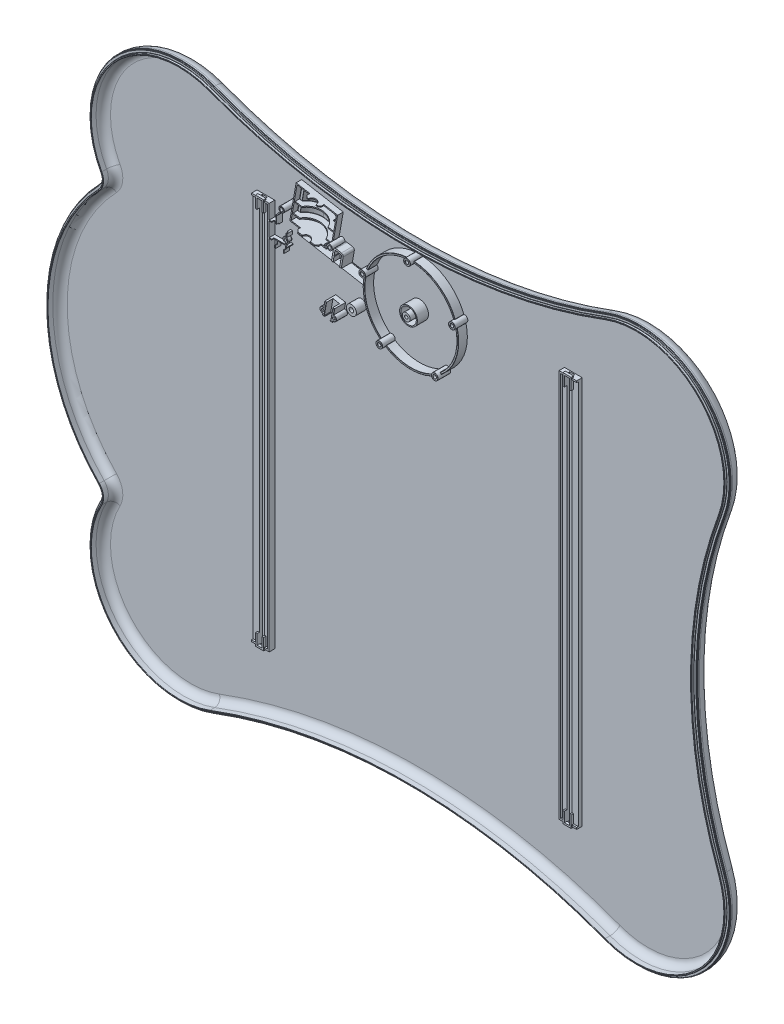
SolidWorks part; units mm, degrees
ref_plane "Face" through (0, 0, 0) normal (0, 0, 1) x (1, 0, 0)
ref_plane "Dessus" through (0, 0, 0) normal (0, 1, 0) x (1, 0, 0)
ref_plane "Droite" through (0, 0, 0) normal (1, 0, 0) x (0, 0, -1)
sketch "Esquisse4" plane through (0, 0, 0) normal (0, 0, 1) x (1, 0, 0)
  line L0 (257.1874, 0) -> (-480.8465, 0) construction
  line L1 (0, 0) -> (0, 296.3249) construction
  arc A0 (-176.824, 244.6687) -> (-278.609, 128.3314) centre (-206, 167.5) ccw
  arc A1 (176.824, 244.6687) -> (283.3693, 138.8601) centre (206, 167.5) cw
  arc A2 (-176.824, 244.6687) -> (176.824, 244.6687) centre (0, 712.358) ccw
  arc A3 (283.3693, 138.8601) -> (283.3693, -138.8601) centre (658.4931, 0) ccw
  arc A4 (-278.609, 128.3314) -> (-280.2321, 116.6212) centre (-287.4101, 123.5836) cw
  arc A5 (-280.2321, 116.6212) -> (-280.2321, -116.6212) centre (-160, 0) ccw
  arc A6 (-278.609, -128.3314) -> (-280.2321, -116.6212) centre (-287.4101, -123.5836) ccw
  arc A7 (-176.824, -244.6687) -> (176.824, -244.6687) centre (0, -712.358) cw
  arc A8 (176.824, -244.6687) -> (283.3693, -138.8601) centre (206, -167.5) ccw
  arc A9 (-176.824, -244.6687) -> (-278.609, -128.3314) centre (-206, -167.5) cw
  dimension "D1" = 82.5
  dimension "D4" = 500
  dimension "D5" = 400
  dimension "D6" = 167.5
  dimension "D8" = 10
  dimension "D2" = 412
  dimension "D3" = 167.5
  dimension "D7" = 160
extrude "Extrusion1" add sketch "Esquisse4" along normal blind 11.5
fillet "Congé1" radius 10
shell "Coque1" thickness 3.5
sketch "Esquisse5" plane through (0, 0, 11.5) normal (0, 0, 1) x (1, 0, 0)
  arc A0 (280.087, 140.0751) -> (178.0618, 241.3949) centre (206, 167.5) ccw construction
  arc A1 (-178.0618, 241.3949) -> (178.0618, 241.3949) centre (0, 712.358) ccw construction
  arc A2 (-178.0618, 241.3949) -> (-275.5286, 129.9931) centre (-206, 167.5) ccw construction
  arc A3 (-277.7198, 114.1843) -> (-275.5286, 129.9931) centre (-287.4101, 123.5836) ccw construction
  arc A4 (-277.7198, 114.1843) -> (-277.7198, -114.1843) centre (-160, 0) ccw construction
  arc A5 (-275.5286, -129.9931) -> (-277.7198, -114.1843) centre (-287.4101, -123.5836) ccw construction
  arc A6 (-275.5286, -129.9931) -> (-178.0618, -241.3949) centre (-206, -167.5) ccw construction
  arc A7 (178.0618, -241.3949) -> (-178.0618, -241.3949) centre (0, -712.358) ccw construction
  arc A8 (178.0618, -241.3949) -> (280.087, -140.0751) centre (206, -167.5) ccw construction
  arc A9 (280.087, 140.0751) -> (280.087, -140.0751) centre (658.4931, 0) ccw construction
  arc A10 (280.087, 140.0751) -> (178.0618, 241.3949) centre (206, 167.5) ccw
  arc A11 (-178.0618, 241.3949) -> (178.0618, 241.3949) centre (0, 712.358) ccw
  arc A12 (-178.0618, 241.3949) -> (-275.5286, 129.9931) centre (-206, 167.5) ccw
  arc A13 (-277.7198, 114.1843) -> (-275.5286, 129.9931) centre (-287.4101, 123.5836) ccw
  arc A14 (-277.7198, 114.1843) -> (-277.7198, -114.1843) centre (-160, 0) ccw
  arc A15 (-275.5286, -129.9931) -> (-277.7198, -114.1843) centre (-287.4101, -123.5836) ccw
  arc A16 (-275.5286, -129.9931) -> (-178.0618, -241.3949) centre (-206, -167.5) ccw
  arc A17 (178.0618, -241.3949) -> (-178.0618, -241.3949) centre (0, -712.358) ccw
  arc A18 (178.0618, -241.3949) -> (280.087, -140.0751) centre (206, -167.5) ccw
  arc A19 (280.087, 140.0751) -> (280.087, -140.0751) centre (658.4931, 0) ccw
  arc A20 (282.9004, 139.0337) -> (177.0009, 244.201) centre (206, 167.5) ccw
  arc A21 (-177.0009, 244.201) -> (177.0009, 244.201) centre (0, 712.358) ccw
  arc A22 (-177.0009, 244.201) -> (-278.169, 128.5687) centre (-206, 167.5) ccw
  arc A23 (-279.8732, 116.2731) -> (-278.169, 128.5687) centre (-287.4101, 123.5836) ccw
  arc A24 (-279.8732, 116.2731) -> (-279.8732, -116.2731) centre (-160, 0) ccw
  arc A25 (-278.169, -128.5687) -> (-279.8732, -116.2731) centre (-287.4101, -123.5836) ccw
  arc A26 (-278.169, -128.5687) -> (-177.0009, -244.201) centre (-206, -167.5) ccw
  arc A27 (177.0009, -244.201) -> (-177.0009, -244.201) centre (0, -712.358) ccw
  arc A28 (177.0009, -244.201) -> (282.9004, -139.0337) centre (206, -167.5) ccw
  arc A29 (282.9004, 139.0337) -> (282.9004, -139.0337) centre (658.4931, 0) ccw
  dimension "D1" = 3
extrude "Extrusion2" add sketch "Esquisse5" along normal blind 1
sketch "Esquisse6" plane through (0, 0, 12.5) normal (0, 0, 1) x (1, 0, 0)
  arc A0 (-178.0618, 241.3949) -> (-275.5286, 129.9931) centre (-206, 167.5) ccw construction
  arc A1 (-277.7198, 114.1843) -> (-275.5286, 129.9931) centre (-287.4101, 123.5836) ccw construction
  arc A2 (-277.7198, 114.1843) -> (-277.7198, -114.1843) centre (-160, 0) ccw construction
  arc A3 (-275.5286, -129.9931) -> (-277.7198, -114.1843) centre (-287.4101, -123.5836) ccw construction
  arc A4 (-275.5286, -129.9931) -> (-178.0618, -241.3949) centre (-206, -167.5) ccw construction
  arc A5 (178.0618, -241.3949) -> (-178.0618, -241.3949) centre (0, -712.358) ccw construction
  arc A6 (178.0618, -241.3949) -> (280.087, -140.0751) centre (206, -167.5) ccw construction
  arc A7 (280.087, 140.0751) -> (280.087, -140.0751) centre (658.4931, 0) ccw construction
  arc A8 (280.087, 140.0751) -> (178.0618, 241.3949) centre (206, 167.5) ccw construction
  arc A9 (-178.0618, 241.3949) -> (178.0618, 241.3949) centre (0, 712.358) ccw construction
  arc A10 (-178.0618, 241.3949) -> (-275.5286, 129.9931) centre (-206, 167.5) ccw
  arc A11 (-277.7198, 114.1843) -> (-275.5286, 129.9931) centre (-287.4101, 123.5836) ccw
  arc A12 (-277.7198, 114.1843) -> (-277.7198, -114.1843) centre (-160, 0) ccw
  arc A13 (-275.5286, -129.9931) -> (-277.7198, -114.1843) centre (-287.4101, -123.5836) ccw
  arc A14 (-275.5286, -129.9931) -> (-178.0618, -241.3949) centre (-206, -167.5) ccw
  arc A15 (178.0618, -241.3949) -> (-178.0618, -241.3949) centre (0, -712.358) ccw
  arc A16 (178.0618, -241.3949) -> (280.087, -140.0751) centre (206, -167.5) ccw
  arc A17 (280.087, 140.0751) -> (280.087, -140.0751) centre (658.4931, 0) ccw
  arc A18 (280.087, 140.0751) -> (178.0618, 241.3949) centre (206, 167.5) ccw
  arc A19 (-178.0618, 241.3949) -> (178.0618, 241.3949) centre (0, 712.358) ccw
  arc A20 (-177.7082, 242.3303) -> (-276.4087, 129.5183) centre (-206, 167.5) ccw
  arc A21 (-278.4376, 114.8806) -> (-276.4087, 129.5183) centre (-287.4101, 123.5836) ccw
  arc A22 (-278.4376, 114.8806) -> (-278.4376, -114.8806) centre (-160, 0) ccw
  arc A23 (-276.4087, -129.5183) -> (-278.4376, -114.8806) centre (-287.4101, -123.5836) ccw
  arc A24 (-276.4087, -129.5183) -> (-177.7082, -242.3303) centre (-206, -167.5) ccw
  arc A25 (177.7082, -242.3303) -> (-177.7082, -242.3303) centre (0, -712.358) ccw
  arc A26 (177.7082, -242.3303) -> (281.0248, -139.728) centre (206, -167.5) ccw
  arc A27 (281.0248, 139.728) -> (281.0248, -139.728) centre (658.4931, 0) ccw
  arc A28 (281.0248, 139.728) -> (177.7082, 242.3303) centre (206, 167.5) ccw
  arc A29 (-177.7082, 242.3303) -> (177.7082, 242.3303) centre (0, 712.358) ccw
  dimension "D1" = 1
extrude "Extrusion3" add sketch "Esquisse6" along normal blind 2
sketch "Esquisse7" plane through (0, 0, 3.5) normal (0, 0, 1) x (1, 0, 0)
  line L0 (0, 0) -> (0, 235.5837) construction
  line L1 (-62.1964, 155) -> (55.3443, 155) construction
  circle A0 centre (0, 155) radius 43
  circle A1 centre (0, 155) radius 41.5
  dimension "D2" = 86
  dimension "D1" = 155
  dimension "D3" = 1.5
extrude "Extrusion4" add sketch "Esquisse7" along normal blind 8
sketch "Esquisse8" plane through (0, 0, 3.5) normal (0, 0, 1) x (1, 0, 0)
  circle A0 centre (0, 155) radius 8
  circle A1 centre (0, 155) radius 7
  dimension "D1" = 16
  dimension "D2" = 1
extrude "Extrusion5" add sketch "Esquisse8" along normal blind 10
sketch "Esquisse9" plane through (0, 0, 3.5) normal (0, 0, 1) x (1, 0, 0)
  circle A0 centre (0, 155) radius 4.5
  dimension "D1" = 9
extrude "Extrusion6" add sketch "Esquisse9" along normal blind 4
sketch "Esquisse10" plane through (0, 0, 7.5) normal (0, 0, 1) x (1, 0, 0)
  circle A0 centre (0, 155) radius 3.5
  circle A1 centre (0, 155) radius 1.5
  dimension "D1" = 7
  dimension "D2" = 3
extrude "Extrusion7" add sketch "Esquisse10" along normal blind 8
sketch "Esquisse11" plane through (0, 0, 3.5) normal (0, 0, 1) x (1, 0, 0)
  line L0 (0, 0) -> (0, 272.4739) construction
  circle A0 centre (0, 197.5) radius 3
  circle A1 centre (0, 155) radius 8 construction
  dimension "D1" = 6
  dimension "D2" = 42.5
extrude "Extrusion8" add sketch "Esquisse11" along normal blind 11.5
sketch "Esquisse13" plane through (0, 0, 15) normal (0, 0, 1) x (1, 0, 0)
  circle A0 centre (0, 197.5) radius 1.5
  dimension "D1" = 3
extrude "Enlèv. mat.-Extru.1" cut sketch "Esquisse13" against normal blind 8
pattern_circular "Répétition circulaire1" count 5 over 360
sketch "Esquisse14" plane through (0, 0, 3.5) normal (0, 0, 1) x (1, 0, 0)
  line L0 (0, 155) -> (-152.5487, 181.8985) construction
  line L1 (0, 155) -> (0, 272.2452) construction
  line L2 (-79.3894, 246.0847) -> (-106.4653, 92.5295) construction
  line L3 (-102.1346, 203.4719) -> (-72.5904, 198.2624)
  line L4 (-102.1346, 203.4719) -> (-109.9488, 159.1555)
  line L6 (-109.9488, 159.1555) -> (-50.8603, 148.7366)
  line L7 (-50.8603, 148.7366) -> (-48.9502, 159.5695)
  line L8 (-48.9502, 159.5695) -> (-78.4944, 164.779)
  line L9 (-72.5904, 198.2624) -> (-78.4944, 164.779)
  dimension "D1" = 80
  dimension "D2" = 94
  dimension "D3" = 30
  dimension "D4" = 15
  dimension "D5" = 30
  dimension "D6" = 45
  dimension "D7" = 60
  dimension "D8" = 11
extrude "Enlèv. mat.-Extru.2" cut sketch "Esquisse14" against normal through all
ref_plane "Plan3" through (31.8897, 180.8552, 0) normal (-0.1736, -0.9848, 0) x (0.9848, -0.1736, 0)
sketch "Esquisse22" plane through (31.8897, 180.8552, 0) normal (-0.1736, -0.9848, 0) x (0.9848, -0.1736, 0)
  line L0 (-138.9155, 3.5) -> (-102.9155, 3.5)
  line L2 (-136.7584, 3.5) -> (-246.2843, 3.5) construction
  line L3 (218.4824, 3.5) -> (-136.7584, 3.5) construction
  line L4 (-135.9155, 0) -> (-135.9155, 3.5) construction
  line L5 (-120.9155, 3.5) -> (-120.9155, 25.653) construction
  line L6 (-130.3422, 12.5) -> (-109.4496, 12.5) construction
  line L7 (-124.7804, -7.25) -> (-117.0506, -7.25)
  line L8 (-136.7584, 0) -> (218.4824, 0) construction
  arc A0 (-138.9155, 3.5) -> (-124.7804, -7.25) centre (-120.9155, 12.5) ccw
  arc A1 (-117.0506, -7.25) -> (-102.9155, 3.5) centre (-120.9155, 12.5) ccw
  dimension "D1" = 3
  dimension "D2" = 3
  dimension "D3" = 9
  dimension "D4" = 7.25
extrude "Extrusion12" add sketch "Esquisse22" along normal up to surface (35 mm away)
sketch "Esquisse23" plane through (25.812, 146.3869, 0) normal (-0.1736, -0.9848, 0) x (0.9848, -0.1736, 0)
  line L0 (-75.9155, 1.75) -> (-135.9155, 1.75) construction
  line L1 (-75.9155, 0) -> (-75.9155, 3.5) construction
  line L2 (-135.9155, 0) -> (-135.9155, 3.5) construction
  line L3 (-105.9155, 1.75) -> (-105.9155, -19.6537) construction
  line L4 (218.4824, 3.5) -> (-136.7584, 3.5) construction
  line L5 (-72.9155, 3.5) -> (-75.1833, 3.5)
  line L6 (-87.0506, -7.25) -> (-124.7804, -7.25)
  line L7 (-87.2495, -5.25) -> (-124.5814, -5.25)
  line L8 (-136.6476, 3.5) -> (-138.9155, 3.5)
  arc A0 (-136.6873, 0) -> (-124.7804, -7.25) centre (-120.9155, 12.5) ccw construction
  arc A1 (-138.9155, 3.5) -> (-124.7804, -7.25) centre (-120.9155, 12.5) ccw
  arc A2 (-72.9155, 3.5) -> (-87.0506, -7.25) centre (-90.9155, 12.5) cw
  arc A3 (-136.6476, 3.5) -> (-124.5814, -5.25) centre (-120.9155, 12.5) ccw
  arc A4 (-75.1833, 3.5) -> (-87.2495, -5.25) centre (-90.9155, 12.5) cw
  dimension "D3" = 2
  dimension "D1" = 2
  dimension "D2" = 2
extrude "Extrusion13" add sketch "Esquisse23" along normal up to surface (11 mm away)
sketch "Esquisse24" plane through (25.812, 146.3869, 0) normal (0.1736, 0.9848, 0) x (-0.9848, 0.1736, 0)
  line L0 (117.0506, -7.25) -> (87.0506, -7.25) construction
  line L1 (-136.7584, 0) -> (218.4824, 0) construction
  line L2 (117.0506, -7.25) -> (87.0506, -7.25)
  line L3 (75.1437, 0) -> (105.1437, 0)
  arc A0 (75.1437, 0) -> (87.0506, -7.25) centre (90.9155, 12.5) ccw construction
  arc A1 (105.1437, 0) -> (117.0506, -7.25) centre (120.9155, 12.5) ccw construction
  arc A2 (75.1437, 0) -> (87.0506, -7.25) centre (90.9155, 12.5) ccw
  arc A3 (105.1437, 0) -> (117.0506, -7.25) centre (120.9155, 12.5) ccw
extrude "Extrusion14" add sketch "Esquisse24" along normal blind 2
sketch "Esquisse25" plane through (23.9018, 135.5541, 0) normal (-0.1736, -0.9848, 0) x (0.9848, -0.1736, 0)
  line L1 (-136.7584, 0) -> (218.4824, 0) construction
  line L2 (-124.7804, -7.25) -> (-87.0506, -7.25) construction
  line L3 (-136.6873, 0) -> (-75.1437, 0)
  line L4 (-124.7804, -7.25) -> (-87.0506, -7.25)
  arc A0 (-87.0506, -7.25) -> (-75.1437, 0) centre (-90.9155, 12.5) ccw construction
  arc A2 (-87.0506, -7.25) -> (-75.1437, 0) centre (-90.9155, 12.5) ccw
  arc A3 (-136.6873, 0) -> (-124.7804, -7.25) centre (-120.9155, 12.5) ccw construction
  arc A4 (-136.6873, 0) -> (-124.7804, -7.25) centre (-120.9155, 12.5) ccw
extrude "Extrusion15" add sketch "Esquisse25" along normal blind 2
ref_plane "Plan4" through (25.9856, 147.3718, 0) normal (-0.1736, -0.9848, 0) x (0.9848, -0.1736, 0)
sketch "Esquisse26" plane through (25.9856, 147.3718, 0) normal (-0.1736, -0.9848, 0) x (0.9848, -0.1736, 0)
  line L0 (-87.2495, -5.25) -> (-124.5814, -5.25) construction
  line L1 (-117.2495, -5.25) -> (-124.5814, -5.25)
  line L2 (-120.9155, 12.5) -> (-120.9155, -25.8677) construction
  line L3 (218.4824, 3.5) -> (-136.7584, 3.5) construction
  line L4 (-105.1833, 3.5) -> (-136.6476, 3.5)
  arc A0 (-135.9155, 2.3264) -> (-124.5814, -5.25) centre (-120.9155, 12.5) ccw construction
  arc A1 (-136.6476, 3.5) -> (-124.5814, -5.25) centre (-120.9155, 12.5) ccw
  arc A2 (-105.1833, 3.5) -> (-117.2495, -5.25) centre (-120.9155, 12.5) cw
extrude "Enlèv. mat.-Extru.3" cut sketch "Esquisse26" against normal blind 31
sketch "Esquisse28" plane through (0, 0, 3.5) normal (0, 0, 1) x (1, 0, 0)
  line L0 (-88.0916, 196.732) -> (-102.8776, 112.8768) construction
  line L1 (-103.203, 201.6294) -> (-108.586, 171.1004) construction
  line L2 (-105.4363, 202.0232) -> (-110.8194, 171.4942)
  line L3 (-110.8194, 171.4942) -> (-75.3663, 165.2428)
  line L4 (-75.3663, 165.2428) -> (-69.9832, 195.7719)
  line L5 (-69.9832, 195.7719) -> (-105.4363, 202.0232)
  line L7 (-72.2166, 196.1657) -> (-103.203, 201.6294) construction
  line L8 (-77.5997, 165.6366) -> (-108.586, 171.1004) construction
  line L9 (-106.7496, 181.5151) -> (-75.7633, 176.0514) construction
  line L10 (-72.2166, 196.1657) -> (-77.5997, 165.6366) construction
  line L11 (-91.2565, 178.7832) -> (-99.8628, 129.9744) construction
  line L12 (-111.9779, 170.683) -> (-74.5552, 164.0844)
  line L13 (-106.2475, 203.1817) -> (-111.9779, 170.683)
  line L14 (-68.8248, 196.583) -> (-106.2475, 203.1817)
  line L15 (-74.5552, 164.0844) -> (-68.8248, 196.583)
  dimension "D1" = 18
  dimension "D2" = 36
  dimension "D3" = 1
extrude "Extrusion16" add sketch "Esquisse28" along normal blind 5
sketch "Esquisse29" plane through (31.5424, 178.8856, 0) normal (0.1736, 0.9848, 0) x (-0.9848, 0.1736, 0)
  line L0 (120.9155, 12.5) -> (120.9155, -18.9804) construction
  line L1 (124.4155, 12.5) -> (125.9155, 12.5)
  line L2 (216.7169, 12.5) -> (-131.9068, 12.5) construction
  line L3 (125.9155, 12.5) -> (127.4155, 11)
  line L5 (127.4155, 11) -> (127.4155, 8.5)
  line L6 (101.9155, 8.5) -> (139.9155, 8.5) construction
  line L7 (114.4155, 8.5) -> (127.4155, 8.5)
  line L8 (114.4155, 11) -> (114.4155, 8.5)
  line L9 (115.9155, 12.5) -> (114.4155, 11)
  line L10 (117.4155, 12.5) -> (115.9155, 12.5)
  arc A0 (117.4155, 12.5) -> (124.4155, 12.5) centre (120.9155, 12.5) ccw
  point P13 (120.9155, 8.5)
  dimension "D1" = 7
  dimension "D2" = 45
  dimension "D3" = 6.5
  dimension "D4" = 5
extrude "Extrusion17" add sketch "Esquisse29" against normal blind 1
sketch "Esquisse30" plane through (25.9856, 147.3718, 0) normal (0.1736, 0.9848, 0) x (-0.9848, 0.1736, 0)
  line L1 (216.7169, 12.5) -> (-131.9068, 12.5) construction
  line L2 (128.4155, 12.5) -> (130.4155, 10.5)
  line L3 (128.4155, 12.5) -> (124.4155, 12.5)
  line L4 (130.4155, 10.5) -> (130.4155, 8.5)
  line L6 (120.9155, 12.5) -> (120.9155, -15.1507) construction
  line L7 (111.4155, 10.5) -> (111.4155, 8.5)
  line L8 (130.4155, 8.5) -> (111.4155, 8.5)
  line L9 (113.4155, 12.5) -> (117.4155, 12.5)
  line L10 (113.4155, 12.5) -> (111.4155, 10.5)
  arc A0 (117.4155, 12.5) -> (124.4155, 12.5) centre (120.9155, 12.5) ccw construction
  arc A1 (117.4155, 12.5) -> (124.4155, 12.5) centre (120.9155, 12.5) ccw
  point P1 (120.9155, 8.5)
  dimension "D1" = 4
  dimension "D2" = 45
  dimension "D3" = 9.5
extrude "Extrusion18" add sketch "Esquisse30" against normal blind 1
sketch "Esquisse32" plane through (0, 0, 3.5) normal (0, 0, 1) x (1, 0, 0)
  line L0 (0, 248.0641) -> (0, -258.8691) construction
  line L1 (-138.5, 221.5243) -> (-138.5, -167.9272) construction
  line L2 (0, 0) -> (-412.5308, 0) construction
  line L3 (-146.5, -175) -> (-146.5, 175)
  line L4 (-146.5, 175) -> (-130.5, 175)
  line L5 (-130.5, 175) -> (-130.5, -175)
  line L6 (-146.5, -175) -> (-130.5, -175)
  line L7 (146.5, -175) -> (130.5, -175)
  line L8 (130.5, 175) -> (130.5, -175)
  line L9 (146.5, 175) -> (130.5, 175)
  line L10 (146.5, -175) -> (146.5, 175)
  arc A0 (-180.3605, 235.3149) -> (180.3605, 235.3149) centre (0, 712.358) ccw construction
  point P15 (-130.5, 0)
  point P16 (-146.5, 0)
  point P20 (146.5, 0)
  point P21 (130.5, 0)
  dimension "D1" = 138.5
  dimension "D2" = 8
  dimension "D3" = 16
  dimension "D4" = 175
extrude "Extrusion20" add sketch "Esquisse32" along normal blind 5
sketch "Esquisse33" plane through (0, 0, 8.5) normal (0, 0, 1) x (1, 0, 0)
  line L6 (-146.5, 173.5) -> (-146.5, -173.5)
  line L7 (132, 173.5) -> (146.5, 173.5)
  line L8 (132, -173.5) -> (132, 173.5)
  line L9 (-146.5, -173.5) -> (-132, -173.5)
  line L10 (-132, -173.5) -> (-132, 173.5)
  line L11 (0, 0) -> (0, -352.7526) construction
  line L12 (146.5, -173.5) -> (132, -173.5)
  line L13 (146.5, 173.5) -> (146.5, -173.5)
  line L20 (-132, 173.5) -> (-146.5, 173.5)
  line L21 (-146.5, -173.5) -> (-132, -173.5)
  line L22 (-132, -173.5) -> (-132, 173.5)
  line L23 (-132, 173.5) -> (-146.5, 173.5)
  dimension "D1" = 1.5
extrude "Enlèv. mat.-Extru.4" cut sketch "Esquisse33" against normal blind 1.5
sketch "Esquisse34" plane through (0, 0, 8.5) normal (0, 0, 1) x (1, 0, 0)
  line L0 (-138.5, 173.5) -> (-138.5, -195.538) construction
  line L2 (0, 0) -> (-306.3583, 0) construction
  line L3 (-140.75, 195.2744) -> (-140.75, -195.2744)
  line L4 (-136.25, 195.2744) -> (-136.25, -195.2744)
  line L5 (-140.75, 195.2744) -> (-136.25, 195.2744)
  line L6 (-140.75, -195.2744) -> (-136.25, -195.2744)
  line L7 (0, 0) -> (0, -269.0537) construction
  line L8 (140.75, -195.2744) -> (136.25, -195.2744)
  line L9 (140.75, 195.2744) -> (136.25, 195.2744)
  line L10 (136.25, 195.2744) -> (136.25, -195.2744)
  line L11 (140.75, 195.2744) -> (140.75, -195.2744)
  line L13 (-146.5, 173.5) -> (-146.5, -173.5) construction
  point P10 (-140.75, 0)
  point P13 (-136.25, 0)
  point P18 (136.25, 0)
  point P19 (140.75, 0)
  dimension "D1" = 2.25
  dimension "D2" = 8
extrude "Enlèv. mat.-Extru.5" cut sketch "Esquisse34" against normal blind 4
sketch "Esquisse37" plane through (0, 0, 7) normal (0, 0, 1) x (1, 0, 0)
  line L0 (-138.5, 189.3964) -> (-138.5, 85.3262) construction
  line L1 (-146.5, 173.5) -> (-146.5, -173.5) construction
  line L2 (-140.75, 174.5) -> (-136.25, 174.5)
  line L3 (-136.25, 174.5) -> (-136.25, 165.5)
  line L4 (-136.25, 165.5) -> (-134.75, 165.5)
  line L5 (-134.75, 165.5) -> (-134.75, 176)
  line L6 (-134.75, 176) -> (-142.25, 176)
  line L7 (-142.25, 165.5) -> (-142.25, 176)
  line L8 (-140.75, 165.5) -> (-142.25, 165.5)
  line L9 (-140.75, 174.5) -> (-140.75, 165.5)
  line L10 (-132, 173.5) -> (-136.25, 173.5) construction
  line L11 (-132, 173.5) -> (-136.25, 173.5) construction
  line L12 (-136.25, -173.5) -> (-136.25, 173.5) construction
  line L13 (0, 0) -> (0, 112) construction
  line L14 (0, 0) -> (-190.78, 0) construction
  line L15 (-140.75, -174.5) -> (-140.75, -165.5)
  line L16 (-140.75, -165.5) -> (-142.25, -165.5)
  line L17 (-142.25, -165.5) -> (-142.25, -176)
  line L18 (-134.75, -176) -> (-142.25, -176)
  line L19 (-134.75, -165.5) -> (-134.75, -176)
  line L20 (-136.25, -165.5) -> (-134.75, -165.5)
  line L21 (-136.25, -174.5) -> (-136.25, -165.5)
  line L22 (-140.75, -174.5) -> (-136.25, -174.5)
  line L23 (140.75, -174.5) -> (136.25, -174.5)
  line L24 (136.25, -174.5) -> (136.25, -165.5)
  line L25 (136.25, -165.5) -> (134.75, -165.5)
  line L26 (134.75, -165.5) -> (134.75, -176)
  line L27 (134.75, -176) -> (142.25, -176)
  line L28 (142.25, -165.5) -> (142.25, -176)
  line L29 (140.75, -165.5) -> (142.25, -165.5)
  line L30 (140.75, -174.5) -> (140.75, -165.5)
  line L31 (140.75, 174.5) -> (140.75, 165.5)
  line L32 (140.75, 165.5) -> (142.25, 165.5)
  line L33 (142.25, 165.5) -> (142.25, 176)
  line L34 (134.75, 176) -> (142.25, 176)
  line L35 (134.75, 165.5) -> (134.75, 176)
  line L36 (136.25, 165.5) -> (134.75, 165.5)
  line L37 (136.25, 174.5) -> (136.25, 165.5)
  line L38 (140.75, 174.5) -> (136.25, 174.5)
  arc A0 (-22.8086, 118.5477) -> (22.8086, 118.5477) centre (0, 155) ccw construction
  point P11 (-138.5, 176)
  point P14 (-138.5, 174.5)
  point P37 (-138.5, -174.5)
  point P38 (-138.5, -176)
  point P47 (138.5, -176)
  point P48 (138.5, -174.5)
  point P57 (138.5, 174.5)
  point P58 (138.5, 176)
  dimension "D1" = 8
  dimension "D2" = 1.5
  dimension "D3" = 1.5
  dimension "D4" = 8
  dimension "D5" = 176
extrude "Extrusion23" add sketch "Esquisse37" along normal blind 2.25
ref_plane "Plan5" through (26.8539, 152.2958, 0) normal (0.1736, 0.9848, 0) x (-0.9848, 0.1736, 0)
sketch "Esquisse38" plane through (26.8539, 152.2958, 0) normal (0.1736, 0.9848, 0) x (-0.9848, 0.1736, 0)
  line L0 (102.9155, 7.5) -> (108.9155, 7.5)
  line L1 (105.1833, 3.5) -> (102.9155, 3.5) construction
  line L2 (102.9155, 8.5) -> (102.9155, 3.5) construction
  line L3 (102.9155, 7.5) -> (102.9155, 3.5)
  line L4 (138.9155, 8.5) -> (138.9155, 3.5) construction
  line L5 (138.9155, 7.5) -> (138.9155, 3.5)
  line L6 (138.9155, 3.5) -> (136.6476, 3.5) construction
  line L7 (124.5814, -5.25) -> (117.2495, -5.25) construction
  line L8 (138.9155, 3.5) -> (136.6476, 3.5)
  line L9 (124.5814, -5.25) -> (117.2495, -5.25)
  line L10 (105.1833, 3.5) -> (102.9155, 3.5)
  line L11 (132.9155, 7.5) -> (138.9155, 7.5)
  arc A0 (108.9155, 7.5) -> (132.9155, 7.5) centre (120.9155, 12.5) ccw
  arc A1 (124.5814, -5.25) -> (136.6476, 3.5) centre (120.9155, 12.5) ccw construction
  arc A2 (105.1833, 3.5) -> (117.2495, -5.25) centre (120.9155, 12.5) ccw construction
  arc A3 (124.5814, -5.25) -> (136.6476, 3.5) centre (120.9155, 12.5) ccw
  arc A4 (105.1833, 3.5) -> (117.2495, -5.25) centre (120.9155, 12.5) ccw
  dimension "D1" = 26
  dimension "D2" = 4
extrude "Extrusion24" add sketch "Esquisse38" along normal blind 1
pattern_linear "Répétition linéaire1" count 2 spacing 10
sketch "Esquisse45" plane through (0, 0, 3.5) normal (0, 0, 1) x (1, 0, 0)
  line L0 (0, 155) -> (-52.4688, 132.7283) construction
  line L1 (0, 155) -> (-74.2356, 155) construction
  circle A0 centre (-52.4688, 132.7283) radius 4.5
  circle A1 centre (-52.4688, 132.7283) radius 2
  dimension "D1" = 4
  dimension "D2" = 9
  dimension "D3" = 23
  dimension "D4" = 57
extrude "Extrusion26" add sketch "Esquisse45" along normal blind 9
sketch "Esquisse39" plane through (0, 0, 3.5) normal (0, 0, 1) x (1, 0, 0)
  line L0 (-61.2189, 183.8823) -> (-65.0067, 162.4007) construction
  line L1 (-50.4475, 146.633) -> (-111.0561, 157.3199) construction
  line L2 (-75.516, 128.7139) -> (-76.4799, 123.2477)
  line L3 (-77.5998, 116.8962) -> (-68.7365, 115.3333)
  line L4 (-75.516, 128.7139) -> (-66.6527, 127.151)
  line L5 (-77.3306, 118.4231) -> (-77.5998, 116.8962)
  line L6 (-68.4673, 116.8603) -> (-68.7365, 115.3333)
  line L7 (-66.6527, 127.151) -> (-67.6166, 121.6849)
  line L8 (-67.7019, 173.0302) -> (-69.4383, 163.1821)
  line L9 (-48.9502, 159.5695) -> (-74.5552, 164.0844) construction
  line L10 (-60.5751, 161.6193) -> (-69.4383, 163.1821)
  line L11 (-71.0844, 127.9325) -> (-79.6, 79.6381) construction
  line L12 (-65.3849, 174.6525) -> (-60.4609, 173.7843)
  line L13 (-58.8386, 171.4674) -> (-60.5751, 161.6193)
  circle A0 centre (-52.4688, 132.7283) radius 2 construction
  arc A2 (-76.4799, 123.2477) -> (-77.3306, 118.4231) centre (-77.3976, 120.9222) ccw
  arc A3 (-67.6166, 121.6849) -> (-68.4673, 116.8603) centre (-67.5495, 119.1858) cw
  arc A4 (-67.7019, 173.0302) -> (-65.3849, 174.6525) centre (-65.7322, 172.6829) cw
  arc A5 (-58.8386, 171.4674) -> (-60.4609, 173.7843) centre (-60.8082, 171.8147) ccw
  circle A6 centre (0, 155) radius 4.5 construction
  point P11 (-73.1682, 116.1148)
  point P20 (-71.0844, 127.9325)
  point P29 (-67.3546, 174.9998)
  point P33 (-62.9229, 174.2184)
  dimension "D1" = 17.5
  dimension "D3" = 51
  dimension "D5" = 5
  dimension "D9" = 2
  dimension "D2" = 9
  dimension "D4" = 12
  dimension "D6" = 5
  dimension "D7" = 4
  dimension "D8" = 12
extrude "Extrusion25" add sketch "Esquisse39" along normal blind 10
sketch "Esquisse46" plane through (0, 0, 13.5) normal (0, 0, 1) x (1, 0, 0)
  line L0 (-66.2246, 172.7698) -> (-67.0061, 168.3381)
  line L1 (-76.0358, 117.1281) -> (-75.5434, 117.0413)
  line L2 (-70.1269, 116.0862) -> (-61.184, 166.8038)
  line L3 (-60.7214, 172.3071) -> (-65.6454, 173.1753)
  line L4 (-60.4609, 173.7843) -> (-65.3849, 174.6525) construction
  line L5 (-67.7019, 173.0302) -> (-69.4383, 163.1821) construction
  line L6 (-60.5751, 161.6193) -> (-58.8386, 171.4674) construction
  line L7 (-77.5998, 116.8962) -> (-68.7365, 115.3333) construction
  line L8 (-67.0061, 168.3381) -> (-66.5137, 168.2513)
  line L9 (-67.0929, 167.8457) -> (-66.6005, 167.7589)
  line L10 (-66.5137, 168.2513) -> (-66.6005, 167.7589)
  line L11 (-61.5896, 167.3831) -> (-61.6764, 166.8906)
  line L12 (-61.6764, 166.8906) -> (-61.184, 166.8038)
  line L13 (-61.5896, 167.3831) -> (-61.0972, 167.2962)
  line L14 (-61.0972, 167.2962) -> (-60.3158, 171.7279)
  line L15 (-67.0929, 167.8457) -> (-76.0358, 117.1281)
  line L16 (-69.4383, 163.1821) -> (-60.5751, 161.6193) construction
  line L17 (-75.5434, 117.0413) -> (-75.6302, 116.5489)
  line L18 (-75.6302, 116.5489) -> (-70.7061, 115.6806)
  line L19 (-70.7061, 115.6806) -> (-70.6193, 116.173)
  line L20 (-70.6193, 116.173) -> (-70.1269, 116.0862)
  arc A0 (-66.2246, 172.7698) -> (-65.6454, 173.1753) centre (-65.7322, 172.6829) cw
  arc A1 (-60.3158, 171.7279) -> (-60.7214, 172.3071) centre (-60.8082, 171.8147) ccw
  dimension "D12" = 0.5
  dimension "D1" = 1.5
  dimension "D2" = 1.5
  dimension "D3" = 1.5
  dimension "D4" = 0.5
  dimension "D5" = 0.5
  dimension "D6" = 0.5
  dimension "D7" = 0.5
  dimension "D8" = 5
  dimension "D9" = 0.5
  dimension "D10" = 0.5
  dimension "D11" = 0.5
extrude "Enlèv. mat.-Extru.6" cut sketch "Esquisse46" against normal blind 6
sketch "Esquisse47" plane through (0, 0, 7.5) normal (0, 0, 1) x (1, 0, 0)
  line L0 (-61.0972, 167.2962) -> (-60.3158, 171.7279) construction
  line L1 (-60.7214, 172.3071) -> (-65.6454, 173.1753) construction
  line L2 (-66.2246, 172.7698) -> (-67.0061, 168.3381) construction
  line L3 (-61.0972, 167.2962) -> (-60.3158, 171.7279)
  line L4 (-60.7214, 172.3071) -> (-65.6454, 173.1753)
  line L5 (-66.2246, 172.7698) -> (-67.0061, 168.3381)
  line L6 (-67.0061, 168.3381) -> (-61.0972, 167.2962)
  arc A0 (-60.3158, 171.7279) -> (-60.7214, 172.3071) centre (-60.8082, 171.8147) ccw construction
  arc A1 (-65.6454, 173.1753) -> (-66.2246, 172.7698) centre (-65.7322, 172.6829) ccw construction
  arc A2 (-60.3158, 171.7279) -> (-60.7214, 172.3071) centre (-60.8082, 171.8147) ccw
  arc A3 (-65.6454, 173.1753) -> (-66.2246, 172.7698) centre (-65.7322, 172.6829) ccw
extrude "Enlèv. mat.-Extru.7" cut sketch "Esquisse47" against normal up to surface (4 mm away)
sketch "Esquisse48" plane through (0, 0, 13.5) normal (0, 0, 1) x (1, 0, 0)
  circle A0 centre (-67.5495, 119.1858) radius 1
  circle A1 centre (-77.3976, 120.9222) radius 1
  dimension "D1" = 2
  dimension "D2" = 2
extrude "Enlèv. mat.-Extru.8" cut sketch "Esquisse48" against normal up to surface (10 mm away)
sketch "Esquisse49" plane through (0, 0, 3.5) normal (0, 0, 1) x (1, 0, 0)
  line L0 (-113.0222, 182.0368) -> (-50.8477, 171.0738) construction
  line L1 (-77.387, 166.6146) -> (-47.8428, 161.4051) construction
  line L2 (-87.1888, 201.852) -> (-99.0061, 134.8329) construction
  line L3 (-71.6566, 199.1132) -> (-102.721, 204.5907) construction
  line L4 (-111.9779, 170.683) -> (-102.6222, 169.0334) construction
  circle A0 centre (-113.0222, 182.0368) radius 2.5
  circle A1 centre (-69.6906, 174.3963) radius 2.5
  dimension "D1" = 5
  dimension "D2" = 22
  dimension "D3" = 11
extrude "Extrusion27" add sketch "Esquisse49" along normal blind 11.5
sketch "Esquisse50" plane through (0, 0, 15) normal (0, 0, 1) x (1, 0, 0)
  circle A0 centre (-69.6906, 174.3963) radius 1.5
  circle A1 centre (-113.0222, 182.0368) radius 1.5
  dimension "D1" = 3
  dimension "D2" = 3
extrude "Enlèv. mat.-Extru.9" cut sketch "Esquisse50" against normal blind 11
sketch "Esquisse51" plane through (0, 0, 8.5) normal (0, 0, 1) x (1, 0, 0)
  line L0 (-83.9108, 165.734) -> (-74.5552, 164.0844) construction
  line L1 (-81.4488, 165.2999) -> (-74.5552, 164.0844)
  line L2 (-74.5552, 164.0844) -> (-68.8248, 196.583) construction
  line L3 (-74.5552, 164.0844) -> (-73.8606, 168.0236)
  line L4 (-73.8606, 168.0236) -> (-80.7542, 169.2392)
  line L5 (-80.7542, 169.2392) -> (-81.4488, 165.2999)
  dimension "D1" = 4
  dimension "D2" = 7
extrude "Enlèv. mat.-Extru.10" cut sketch "Esquisse51" against normal up to surface (5 mm away)
sketch "Esquisse52" plane through (0, 0, 3.5) normal (0, 0, 1) x (1, 0, 0)
  line L0 (-81.2752, 166.2847) -> (-81.0147, 167.7619)
  line L1 (-81.0147, 167.7619) -> (-80.2761, 167.6317)
  line L2 (-80.2761, 167.6317) -> (-80.5366, 166.1545)
  line L3 (-81.2752, 166.2847) -> (-77.5997, 165.6366) construction
  line L4 (-80.5366, 166.1545) -> (-81.2752, 166.2847)
  line L5 (-81.2752, 166.2847) -> (-81.4488, 165.2999) construction
  dimension "D1" = 0.75
  dimension "D2" = 1.5
extrude "Extrusion28" add sketch "Esquisse52" against normal up to body separate body
sketch "Esquisse53" plane through (0, 0, 3.5) normal (0, 0, 1) x (1, 0, 0)
  line L0 (-80.5366, 166.1545) -> (-80.2761, 167.6317) construction
  line L1 (-80.2761, 167.6317) -> (-81.0147, 167.7619) construction
  line L2 (-81.0147, 167.7619) -> (-81.2752, 166.2847) construction
  line L3 (-80.5366, 166.1545) -> (-80.2761, 167.6317)
  line L4 (-80.2761, 167.6317) -> (-81.0147, 167.7619)
  line L5 (-81.0147, 167.7619) -> (-81.4488, 165.2999)
  line L6 (-69.4383, 163.1821) -> (-81.4488, 165.2999) construction
  line L7 (-69.4383, 163.1821) -> (-70.4231, 163.3558)
  line L8 (-70.8515, 190.8478) -> (-72.3287, 191.1083)
  line L9 (-74.8454, 168.1973) -> (-69.9832, 195.7719) construction
  line L10 (-72.3287, 191.1083) -> (-72.4589, 190.3697)
  line L11 (-72.4589, 190.3697) -> (-70.9817, 190.1092)
  line L12 (-69.9832, 195.7719) -> (-72.2166, 196.1657) construction
  line L13 (-69.9832, 195.7719) -> (-81.3085, 197.7688) construction
  line L14 (-70.9817, 190.1092) -> (-70.8515, 190.8478)
  line L15 (-75.8302, 168.3709) -> (-72.8758, 167.85)
  line L16 (-72.8758, 167.85) -> (-73.006, 167.1114)
  line L17 (-73.006, 167.1114) -> (-75.9604, 167.6323)
  line L18 (-75.9604, 167.6323) -> (-75.8302, 168.3709)
  line L19 (-73.8606, 168.0236) -> (-74.8454, 168.1973) construction
  line L20 (-73.8606, 168.0236) -> (-68.8248, 196.583) construction
  line L21 (-69.3081, 163.9208) -> (-70.2929, 164.0944)
  line L22 (-67.7358, 172.838) -> (-69.4383, 163.1821) construction
  line L23 (-70.2929, 164.0944) -> (-70.4231, 163.3558)
  line L24 (-79.233, 164.9092) -> (-81.4488, 165.2999)
  line L25 (-69.3081, 163.9208) -> (-69.4383, 163.1821)
  line L26 (-80.5366, 166.1545) -> (-77.5997, 165.6366) construction
  line L27 (-80.5366, 166.1545) -> (-79.0594, 165.894)
  line L28 (-79.0594, 165.894) -> (-79.233, 164.9092)
  dimension "D1" = 0.75
  dimension "D2" = 1.5
  dimension "D3" = 5
  dimension "D4" = 1
  dimension "D5" = 1
  dimension "D6" = 0.75
  dimension "D7" = 1
  dimension "D8" = 0.75
  dimension "D9" = 1.5
extrude "Extrusion29" add sketch "Esquisse53" along normal up to surface (5 mm away)
sketch "Esquisse55" plane through (0, 0, 3.5) normal (0, 0, 1) x (1, 0, 0)
  line L0 (-130.5, -175) -> (-130.5, 175) construction
  line L1 (-130.5, 161.25) -> (-130.5, 162)
  line L2 (-130.5, 162) -> (-124.5, 162)
  line L3 (-124.5, 162) -> (-124.5, 168.9415)
  line L4 (-124.5, 168.9415) -> (-114.8982, 180.3844)
  line L5 (-113.0222, 182.0368) -> (-121.5511, 171.8724) construction
  line L6 (-123.75, 168.6685) -> (-114.3237, 179.9024)
  line L7 (-123.75, 168.6685) -> (-123.75, 161.25)
  line L8 (-123.75, 161.25) -> (-130.5, 161.25)
  line L9 (-130.5, 175) -> (-134.75, 175) construction
  line L10 (-130.5, 148.25) -> (-117.875, 148.25)
  line L11 (-130.5, 147.5) -> (-125.625, 147.5)
  line L12 (-130.5, 148.25) -> (-130.5, 147.5)
  line L13 (-117.5, 152.25) -> (-117.5, 144.7911) construction
  line L14 (-117.875, 150.0315) -> (-117.875, 148.25)
  line L15 (-117.125, 150.0315) -> (-117.125, 148.25)
  line L16 (-116.375, 148.25) -> (-116.375, 147.5)
  line L17 (-121.375, 158.4364) -> (-121.375, 154.2498) construction
  line L18 (-117.125, 148.25) -> (-116.375, 148.25)
  line L19 (-117.875, 147.5) -> (-117.875, 142.5)
  line L20 (-124.875, 147.5) -> (-124.875, 142.5)
  line L21 (-117.875, 142.5) -> (-117.125, 142.5)
  line L22 (-124.875, 142.5) -> (-125.625, 142.5)
  line L23 (-117.125, 142.5) -> (-117.125, 147.5)
  line L24 (-125.625, 142.5) -> (-125.625, 147.5)
  line L25 (-117.125, 147.5) -> (-116.375, 147.5)
  line L26 (-124.875, 147.5) -> (-117.875, 147.5)
  line L27 (-116.25, 158.5) -> (-115.25, 158.5)
  line L28 (-116, 148.5) -> (-114, 148.5)
  line L29 (-116, 148.5) -> (-116, 149.25)
  line L30 (-116, 149.25) -> (-114, 149.25)
  line L31 (-114, 148.5) -> (-114, 149.25)
  line L32 (-114.5, 156.25) -> (-116.25, 156.25)
  line L33 (-114.5, 156.25) -> (-114.5, 159.25)
  line L34 (-114.5, 159.25) -> (-116.25, 159.25)
  line L35 (-116.25, 156.25) -> (-116.25, 157)
  line L36 (-115.25, 158.5) -> (-115.25, 157)
  line L37 (-115.25, 157) -> (-116.25, 157)
  line L38 (-116.25, 158.5) -> (-116.25, 159.25)
  circle A0 centre (-113.0222, 182.0368) radius 2.5 construction
  arc A1 (-114.8982, 180.3844) -> (-114.3237, 179.9024) centre (-113.0222, 182.0368) ccw
  arc A2 (-117.125, 150.0315) -> (-117.875, 150.0315) centre (-117.5, 152.25) ccw
  circle A3 centre (-117.5, 152.25) radius 1
  dimension "D9" = 2
  dimension "D10" = 4.5
  dimension "D1" = 0.75
  dimension "D2" = 0.75
  dimension "D3" = 0.75
  dimension "D4" = 13
  dimension "D5" = 6
  dimension "D6" = 140
  dimension "D7" = 13
  dimension "D8" = 0.75
  dimension "D11" = 4
  dimension "D12" = 13
  dimension "D13" = 0.75
  dimension "D14" = 0.75
  dimension "D15" = 7
  dimension "D16" = 5
  dimension "D17" = 0.75
  dimension "D18" = 0.75
  dimension "D19" = 1.5
  dimension "D20" = 1
  dimension "D21" = 0.75
  dimension "D22" = 14.5
  dimension "D23" = 14.25
  dimension "D24" = 2
  dimension "D25" = 7
  dimension "D26" = 2
  dimension "D27" = 0.75
extrude "Extrusion30" add sketch "Esquisse55" along normal up to surface (5 mm away)
sketch "Esquisse56" plane through (0, 0, 8.5) normal (0, 0, 1) x (1, 0, 0)
  line L0 (-115.25, 157) -> (-115.25, 158.5) construction
  line L1 (-128.25, 162) -> (-115.25, 162)
  line L2 (-128.25, 162) -> (-128.25, 145)
  line L3 (-128.25, 145) -> (-115.25, 145)
  line L4 (-115.25, 162) -> (-115.25, 145)
  line L5 (-130.5, 162) -> (-124.5, 162) construction
  dimension "D1" = 13
  dimension "D2" = 17
extrude "Enlèv. mat.-Extru.11" cut sketch "Esquisse56" against normal blind 2
sketch "Esquisse57" plane through (0, 0, 6.5) normal (0, 0, 1) x (1, 0, 0)
  circle A0 centre (-117.5, 152.25) radius 1
  circle A1 centre (-117.5, 152.25) radius 2.25
  arc A2 (-117.125, 150.0315) -> (-117.875, 150.0315) centre (-117.5, 152.25) ccw construction
  circle A3 centre (-117.5, 152.25) radius 1 construction
extrude "Extrusion31" add sketch "Esquisse57" along normal blind 0.5
sketch "Esquisse58" plane through (0, 0, 0) normal (0, 0, -1) x (-1, 0, 0)
  circle A0 centre (0, 155) radius 12
  circle A1 centre (0, 155) radius 10
  dimension "D1" = 24
  dimension "D3" = 20
extrude "Extrusion37" add sketch "Esquisse58" along normal blind 10
sketch "Esquisse59" plane through (0, 0, 0) normal (0, 0, -1) x (-1, 0, 0)
  circle A0 centre (0, 155) radius 4
  dimension "D1" = 8
extrude "Extrusion38" add sketch "Esquisse59" along normal blind 10
sketch "Esquisse60" plane through (0, 0, 0) normal (0, 0, -1) x (-1, 0, 0)
  line L0 (0, 155) -> (12.3384, 167.3384) construction
  line L1 (0, 155) -> (18.5792, 155) construction
  line L3 (2.4527, 158.1598) -> (6.7087, 162.4158)
  line L4 (3.1598, 157.4527) -> (7.4158, 161.7087)
  circle A0 centre (0, 155) radius 10 construction
  arc A1 (7.4158, 161.7087) -> (6.7087, 162.4158) centre (0, 155) ccw
  circle A2 centre (0, 155) radius 4 construction
  arc A3 (3.1598, 157.4527) -> (2.4527, 158.1598) centre (0, 155) ccw
  dimension "D1" = 45
extrude "Extrusion39" add sketch "Esquisse60" along normal blind 8
pattern_circular "Répétition circulaire2" count 4 over 360
sketch "Esquisse61" plane through (0, 0, 7.5) normal (0, 0, 1) x (1, 0, 0)
  circle A0 centre (0, 155) radius 1.5 construction
  circle A1 centre (0, 155) radius 1.5
extrude "Enlèv. mat.-Extru.12" cut sketch "Esquisse61" against normal blind 8
fillet "Congé2" radius 0.2
